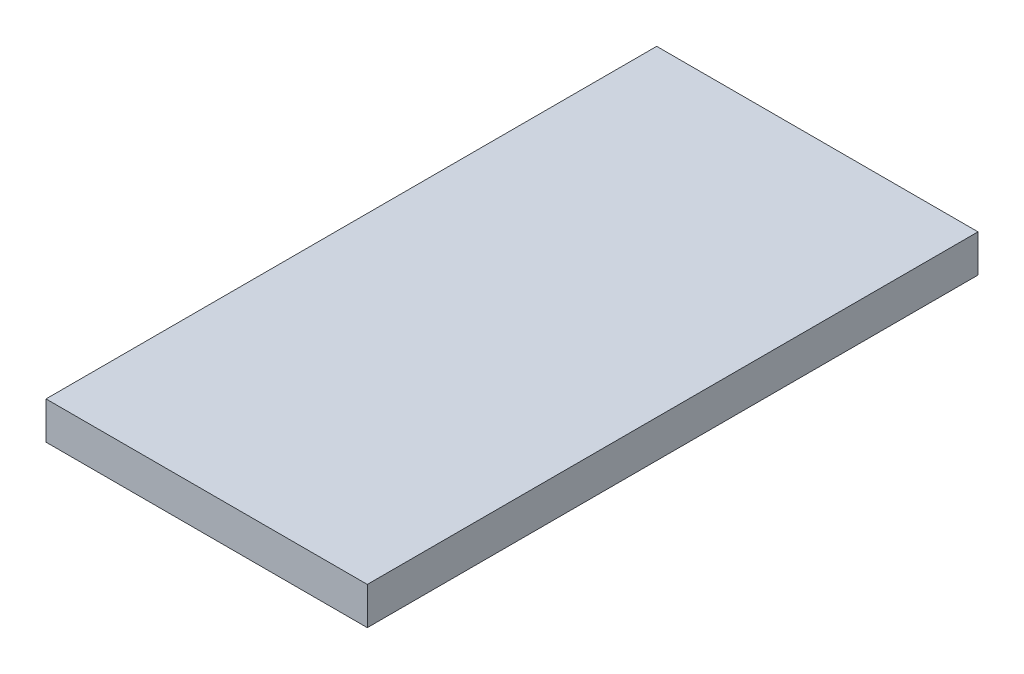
SolidWorks part; units mm, degrees
ref_plane "Plan de face" through (0, 0, 0) normal (0, 0, 1) x (1, 0, 0)
ref_plane "Plan de dessus" through (0, 0, 0) normal (0, 1, 0) x (1, 0, 0)
ref_plane "Plan de droite" through (0, 0, 0) normal (1, 0, 0) x (0, 0, -1)
sketch "Esquisse1" plane through (0, 0, 0) normal (0, 0, 1) x (1, 0, 0)
  line L0 (450, 410) -> (450, 0) construction
  line L1 (450, 191.5) -> (218.5, 191.5)
  line L2 (450, 191.5) -> (450, 218.5)
  line L3 (450, 218.5) -> (218.5, 218.5)
  line L4 (218.5, 191.5) -> (218.5, 218.5)
  line L5 (0, 0) -> (410, 410) construction
  line L6 (650.0245, 205) -> (228.7208, 205) construction
  line L7 (410, 410) -> (450, 410) construction
  line L8 (450, 0) -> (0, 0) construction
  dimension "D1" = 27
  dimension "D2" = 191.5
extrude "Boss.-Extru.1" add sketch "Esquisse1" along normal up to surface (440 mm away)
